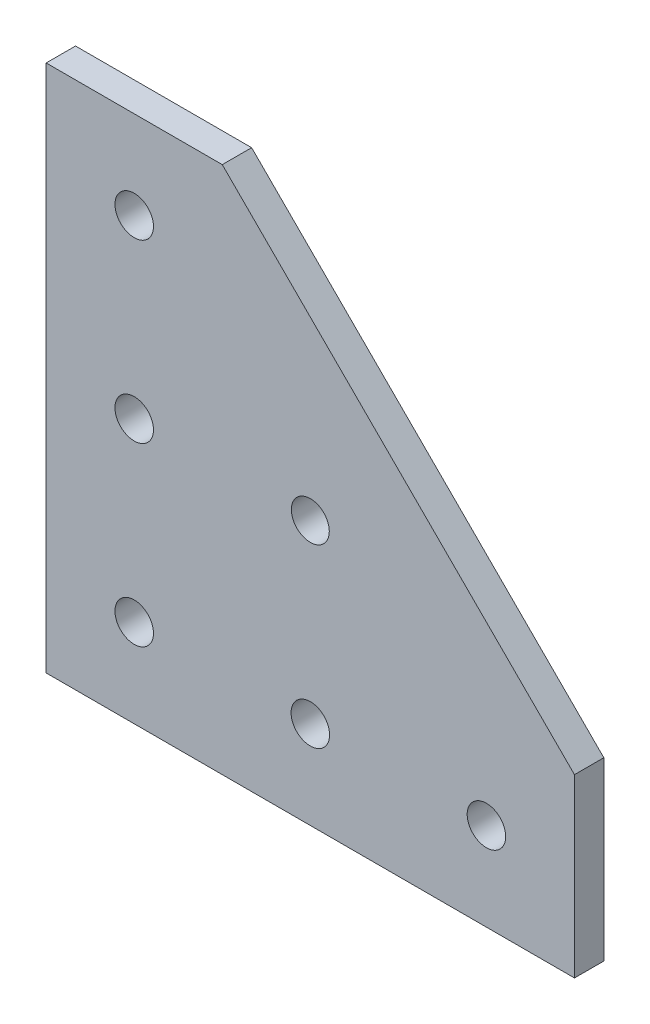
SolidWorks part; units mm, degrees
ref_plane "Front Plane" through (0, 0, 0) normal (0, 0, 1) x (1, 0, 0)
ref_plane "Top Plane" through (0, 0, 0) normal (0, 1, 0) x (1, 0, 0)
ref_plane "Right Plane" through (0, 0, 0) normal (1, 0, 0) x (0, 0, -1)
sketch "Sketch1" plane through (0, 0, 0) normal (0, 0, 1) x (1, 0, 0)
  line L0 (0, 0) -> (0, 114.3)
  line L1 (19.05, 19.05) -> (57.15, 19.05) construction
  line L2 (57.15, 19.05) -> (95.25, 19.05) construction
  line L3 (19.05, 19.05) -> (19.05, 57.15) construction
  line L4 (114.3, 38.1) -> (38.1, 114.3)
  line L5 (114.3, 0) -> (0, 0)
  line L6 (19.05, 57.15) -> (19.05, 95.25) construction
  line L7 (114.3, 38.1) -> (114.3, 0)
  line L8 (0, 114.3) -> (38.1, 114.3)
  circle A0 centre (19.05, 19.05) radius 4.1656
  circle A1 centre (57.15, 19.05) radius 4.1656
  circle A2 centre (95.25, 19.05) radius 4.1656
  circle A3 centre (19.05, 57.15) radius 4.1656
  circle A4 centre (19.05, 95.25) radius 4.1656
  dimension "D1" = 38.1
  dimension "E" = 8.3312
  dimension "D2" = 19.05
  dimension "C" = 38.1
  dimension "D3" = 19.05
  dimension "B" = 114.3
extrude "Boss-Extrude1" add sketch "Sketch1" along normal mid plane 6.35
sketch "Sketch2" plane through (0, 0, 0) normal (0, 0, 1) x (1, 0, 0)
  line L0 (0, 0) -> (114.3, 0) construction
  line L1 (0, 114.3) -> (0, 0) construction
  point P0 (57.15, 57.15)
  dimension "D1" = 57.15
  dimension "D2" = 57.15
hole_wizard "5/16 Clearance Hole1" positions "Sketch3" profile "Sketch4" hole size "5/16" standard "ANSI Inch"
sketch "Sketch3" plane through (0, 0, 3.175) normal (0, 0, 1) x (1, 0, 0)
  point P0 (57.15, 57.15)
sketch "Sketch4" plane through (57.15, 57.15, 3.175) normal (1, 0, 0) x (0, -1, 0)
  line L0 (0, 0) -> (0, 6.35)
  line L1 (0, 6.35) -> (4.1021, 6.35)
  line L2 (4.1021, 6.35) -> (4.1021, 0)
  line L5 (4.1021, 0) -> (0, 0)
  line L11 (0, -6.35) -> (0, 107.95) construction
  dimension "Thru Hole Dia." = 8.2042
  dimension "Thru Hole Depth" = 6.35
